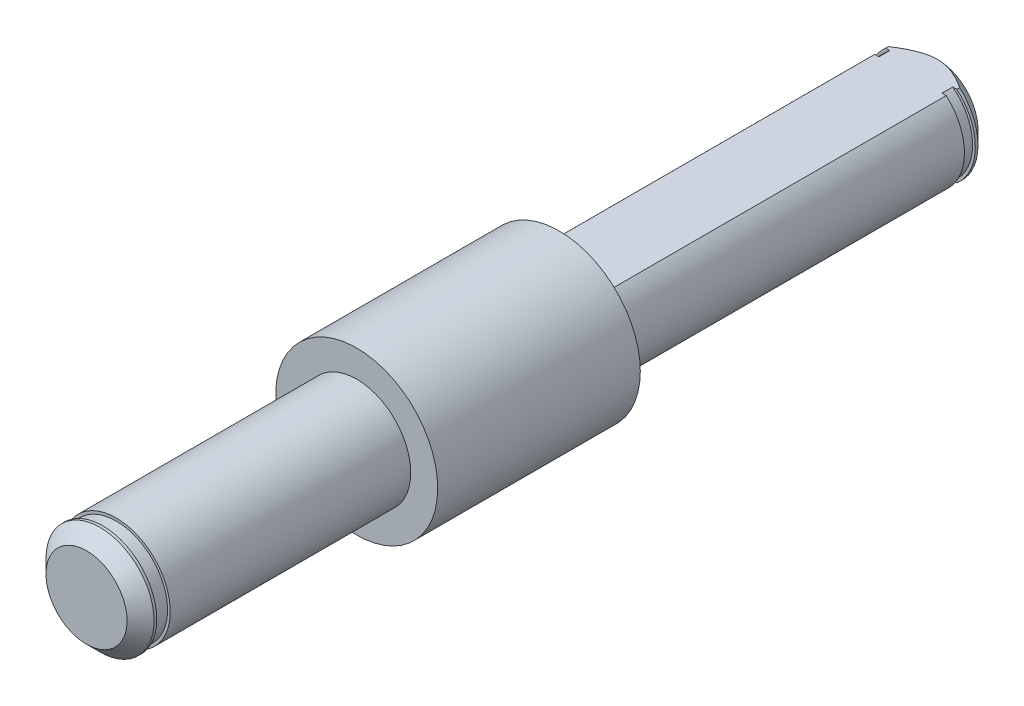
SolidWorks part; units mm, degrees
ref_plane "Plan de face" through (0, 0, 0) normal (0, 0, 1) x (1, 0, 0)
ref_plane "Plan de dessus" through (0, 0, 0) normal (0, 1, 0) x (1, 0, 0)
ref_plane "Plan de droite" through (0, 0, 0) normal (1, 0, 0) x (0, 0, -1)
sketch "Esquisse1" plane through (0, 0, 0) normal (0, 0, 1) x (1, 0, 0)
  circle A0 centre (0, 0) radius 3
  dimension "D1" = 6
extrude "Extrusion1" add sketch "Esquisse1" along normal blind 7.5
sketch "Esquisse2" plane through (0, 0, 7.5) normal (0, 0, 1) x (1, 0, 0)
  circle A0 centre (0, 0) radius 2
  dimension "D1" = 4
extrude "Extrusion2" add sketch "Esquisse2" along normal blind 10
chamfer "Chanfrein1" distance 0.5 angle 45 1 edges at (2, 0, 17.5)
sketch "Esquisse3" plane through (0, 0, 0) normal (1, 0, 0) x (0, 0, -1)
  line L0 (-7.5, 3) -> (-7.5, -3) construction
  line L1 (-16.4, 2.4375) -> (-16.9, 2.4375)
  line L2 (-16.4, 2.4375) -> (-16.4, 1.9)
  line L3 (-16.4, 1.9) -> (-16.9, 1.9)
  line L4 (-16.9, 2.4375) -> (-16.9, 1.9)
  line L5 (0, 0) -> (-19.8752, 0) construction
  dimension "D1" = 9.4
  dimension "D2" = 0.5
  dimension "D3" = 1.9
revolve "Enlèvement de matière-Révolution1" cut sketch "Esquisse3" angle 360 about L5
sketch "Esquisse9" plane through (0, 0, 0) normal (0, 0, -1) x (-1, 0, 0)
  circle A0 centre (0, 0) radius 2
  dimension "D1" = 4
extrude "Extrusion4" add sketch "Esquisse9" along normal blind 14
chamfer "Chanfrein4" distance 0.5 angle 45 1 edges at (-2, 0, -14)
sketch "Esquisse10" plane through (0, 0, -14) normal (0, 0, -1) x (-1, 0, 0)
  line L1 (-2.3184, 1.5) -> (2.274, 1.5)
  line L2 (-2.3184, 1.5) -> (-2.3184, -1.5)
  line L3 (-2.3184, -1.5) -> (2.274, -1.5)
  line L4 (2.274, 1.5) -> (2.274, -1.5)
  dimension "D1" = 3
  dimension "D2" = 1.5
extrude "Enlèv. mat.-Extru.3" cut sketch "Esquisse10" against normal blind 14 flip side to cut
sketch "Esquisse12" plane through (0, 0, 0) normal (1, 0, 0) x (0, 0, -1)
  line L0 (0, -3) -> (0, 3) construction
  line L1 (13.4, 2.1018) -> (13, 2.1018)
  line L2 (13.4, 2.1018) -> (13.4, 1.9)
  line L3 (13.4, 1.9) -> (13, 1.9)
  line L4 (13, 2.1018) -> (13, 1.9)
  line L5 (0, 0) -> (19.0137, 0) construction
  dimension "D1" = 13.4
  dimension "D2" = 0.4
  dimension "D3" = 1.9
revolve "Enlèvement de matière-Révolution4" cut sketch "Esquisse12" angle 360 about L5
